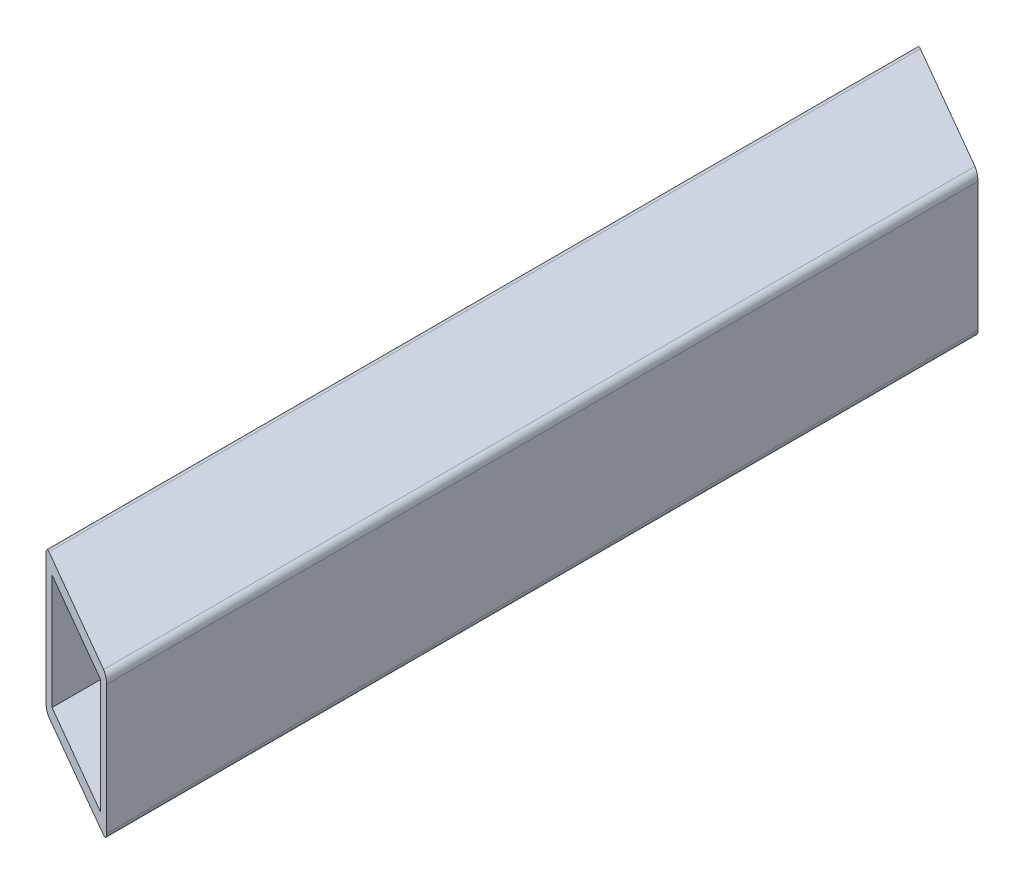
SolidWorks part; units mm, degrees
ref_plane "Plan1" through (0, 0, 0) normal (0, 0, 1) x (1, 0, 0)
ref_plane "Plan2" through (0, 0, 0) normal (0, 1, 0) x (1, 0, 0)
ref_plane "Plan3" through (0, 0, 0) normal (1, 0, 0) x (0, 0, -1)
sketch "Esquisse1" plane through (0, 0, 0) normal (0, 0, 1) x (1, 0, 0)
  line L0 (-9, 10) -> (9, 10)
  line L1 (-10, 9) -> (-10, -9)
  line L2 (9, -10) -> (-9, -10)
  line L3 (10, -9) -> (10, 9)
  line L4 (9, 9) -> (-9, -9) construction
  arc A0 (-9, -10) -> (-10, -9) centre (-9, -9) cw
  arc A1 (-10, 9) -> (-9, 10) centre (-9, 9) cw
  arc A2 (10, 9) -> (9, 10) centre (9, 9) ccw
  arc A3 (10, -9) -> (9, -10) centre (9, -9) cw
  dimension "D1" = 1
  dimension "D2" = 20
extrude "Base-Extru.-Mince" add sketch "Esquisse1" along normal blind 133 thin
sketch "Esquisse2" plane through (0, 10, 0) normal (0, 1, 0) x (-1, 0, 0)
  line L0 (23.8619, -8.0032) -> (-10.9729, 12.1087)
  line L1 (-10.9729, 12.1087) -> (-10.9729, 133.5617)
  line L2 (-10.9729, 133.5617) -> (42.4344, 102.727)
  line L3 (10, 133) -> (10, 0) construction
  line L4 (-10, 133) -> (-10, 0) construction
  spline_without_curve S0
  dimension "D1" = 60
  dimension "D2" = 60
extrude "Enlèv. mat.-Extru.1" cut sketch "Esquisse2" against normal through all
